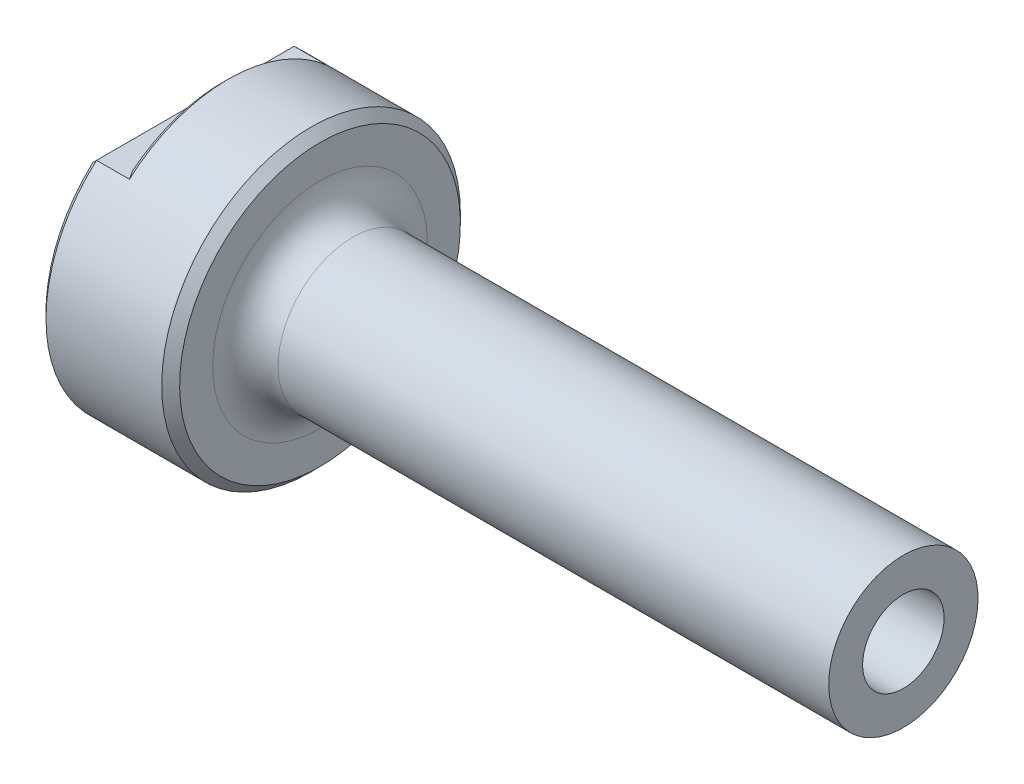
SolidWorks part; units mm, degrees
ref_plane "Front Plane" through (0, 0, 0) normal (0, 0, 1) x (1, 0, 0)
ref_plane "Top Plane" through (0, 0, 0) normal (0, 1, 0) x (1, 0, 0)
ref_plane "Right Plane" through (0, 0, 0) normal (1, 0, 0) x (0, 0, -1)
sketch "Sketch1" plane through (0, 0, 0) normal (1, 0, 0) x (0, 0, -1)
  circle A0 centre (0, 0) radius 25.4
  dimension "Rod Dia" = 50.8
extrude "Boss-Extrude1" add sketch "Sketch1" along normal mid plane 121.4438 contours A0
sketch "Sketch3" plane through (-60.7219, 0, 0) normal (-1, 0, 0) x (0, 0, 1)
  line L1 (-25.4, 25.4) -> (25.4, 25.4)
  line L2 (-25.4, 25.4) -> (-25.4, 19.05)
  line L3 (-25.4, 19.05) -> (25.4, 19.05)
  line L4 (25.4, 25.4) -> (25.4, 19.05)
  line L5 (-25.4, 25.4) -> (25.4, 19.05) construction
  line L6 (-25.4, 19.05) -> (25.4, 25.4) construction
  circle A0 centre (0, 0) radius 25.4 construction
  point P0 (0, 22.225)
  dimension "D1" = 19.05
extrude "Cut-Extrude1" cut sketch "Sketch3" against normal blind 5.588
sketch "Sketch5" plane through (0, 0, 0) normal (0, 0, 1) x (1, 0, 0)
  line L0 (60.7219, 0) -> (-60.7219, 0) construction
  line L1 (60.7219, -25.4) -> (60.7219, 25.4) construction
  line L2 (-60.7219, 19.05) -> (-60.7219, -25.4) construction
  line L3 (-38.4969, -12.7) -> (60.7219, -12.7)
  line L4 (60.7219, -12.7) -> (60.7219, -25.4)
  line L5 (60.7219, -25.4) -> (-38.4969, -25.4)
  line L6 (-60.7219, -25.4) -> (60.7219, -25.4) construction
  line L7 (-38.4969, -25.4) -> (-38.4969, -12.7)
  dimension "B" = 22.225
  dimension "D" = 25.4
revolve "Cut-Revolve1" cut sketch "Sketch5" angle 360 about L0
sketch "Sketch6" plane through (0, 0, 0) normal (0, 0, 1) x (1, 0, 0)
  line L0 (60.7219, 0) -> (-60.7219, 0) construction
  line L1 (60.7219, -12.7) -> (60.7219, 12.7) construction
  line L2 (-60.7219, 19.05) -> (-60.7219, -25.4) construction
  line L3 (-56.0991, 0) -> (-60.7219, 0)
  line L5 (-60.7219, 9.8005) -> (-60.7219, 0)
  arc A0 (-60.7219, 9.8005) -> (-56.0991, 0) centre (-68.7991, 0) cw
  dimension "D1" = 12.7
  dimension "D2" = 4.6228
revolve "Cut-Revolve2" cut sketch "Sketch6" angle 360 about L0
sketch "Sketch7" plane through (0, 0, 0) normal (0, 0, 1) x (1, 0, 0)
  line L0 (-56.873, 4.3656) -> (60.7219, 6.9316)
  line L2 (60.7219, -12.7) -> (60.7219, 12.7) construction
  line L3 (-56.873, 0) -> (60.7219, 0)
  line L4 (60.7219, 0) -> (-60.7219, 0) construction
  line L5 (-60.7219, 19.05) -> (-60.7219, -25.4) construction
  line L6 (60.7219, 6.9316) -> (60.7219, 0)
  line L7 (-56.873, 4.3656) -> (-56.873, 0)
  line L8 (60.7219, 0) -> (41.1743, 0.1051)
  arc A1 (-60.7219, -9.8005) -> (-60.7219, 9.8005) centre (-68.7991, 0) ccw construction
  dimension "D1" = 1.25
  dimension "D2" = 8.7312
revolve "Cut-Revolve3" cut sketch "Sketch7" angle 360 about L4
fillet "Fillet1" radius 5.5562 1 edges at (-38.4969, 12.7, 0)
chamfer "Chamfer1" distance 1.524 angle 45 1 edges at (-38.4969, 25.4, 0)
chamfer "Chamfer2" distance 1.016 angle 45 3 edges at (-55.1339, 25.4, 0) (-60.7219, -25.4, 0) (-60.7219, 19.05, 0)
